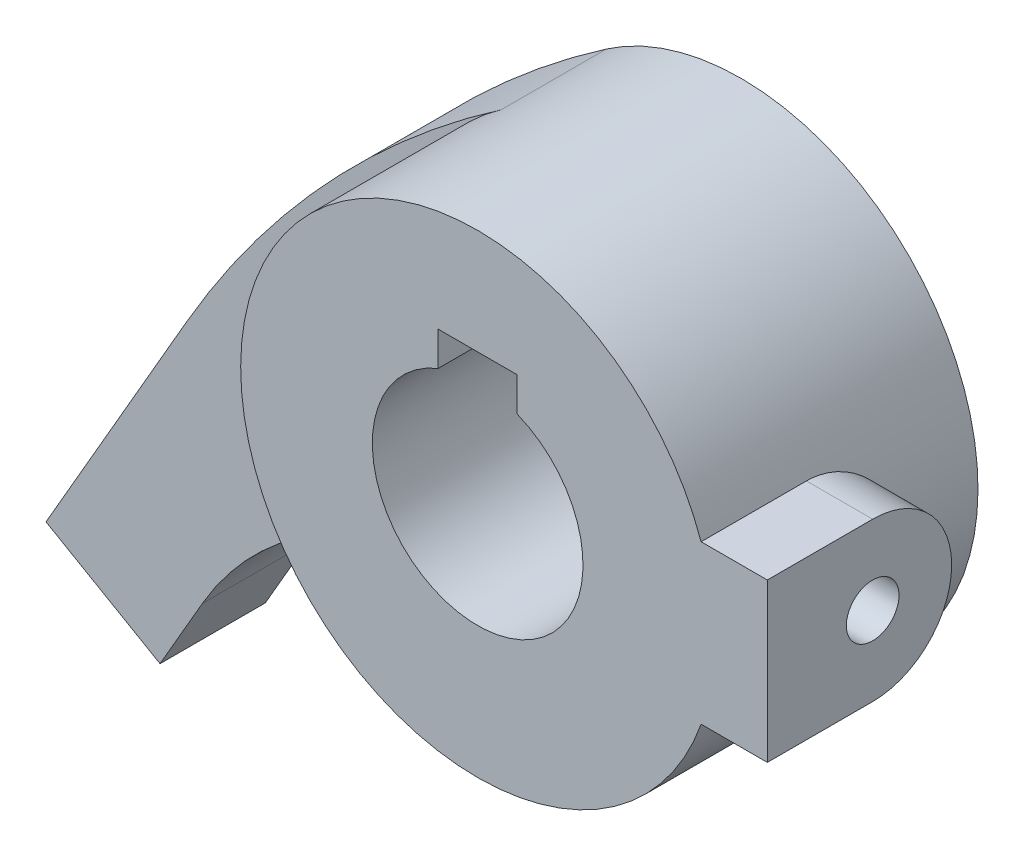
SolidWorks part; units mm, degrees
ref_plane "前视基准面" through (0, 0, 0) normal (0, 0, 1) x (1, 0, 0)
ref_plane "上视基准面" through (0, 0, 0) normal (0, 1, 0) x (1, 0, 0)
ref_plane "右视基准面" through (0, 0, 0) normal (1, 0, 0) x (0, 0, -1)
sketch "草图1" plane through (0, 0, 0) normal (0, 0, 1) x (1, 0, 0)
  line L0 (0, 11.715) -> (0, -12.6704) construction
  line L1 (-12.634, 0) -> (12.1078, 0) construction
  line L2 (-3, 7.4162) -> (-3, 10)
  line L3 (-3, 10) -> (3, 10)
  line L4 (3, 7.4162) -> (3, 10)
  arc A0 (-3, 7.4162) -> (3, 7.4162) centre (0, 0) ccw
  circle A1 centre (0, 0) radius 18
  point P13 (0, 10)
  dimension "D1" = 36
  dimension "D2" = 16
  dimension "D4" = 10
  dimension "D3" = 6
extrude "凸台-拉伸1" add sketch "草图1" along normal blind 20
ref_plane "基准面1" through (22, 0, 0) normal (1, 0, 0) x (0, 0, -1)
sketch "草图2" plane through (22, 0, 0) normal (1, 0, 0) x (0, 0, -1)
  line L0 (-24.8754, 0) -> (-6.9723, 0) construction
  line L1 (-12, 6.7466) -> (-12, -9.8402) construction
  line L2 (-20, 18) -> (-20, -18) construction
  line L3 (-12, 6) -> (-20, 6)
  line L4 (-12, -6) -> (-20, -6)
  line L5 (-20, 6) -> (-20, -6)
  arc A1 (-12, -6) -> (-12, 6) centre (-12, 0) ccw
  dimension "D1" = 6
  dimension "D3" = 8
extrude "凸台-拉伸2" add sketch "草图2" against normal up to next
sketch "草图3" plane through (0, 0, 0) normal (0, 0, 1) x (1, 0, 0)
  line L0 (-34.0887, -11.0434) -> (-44.7846, -29.5692)
  line L1 (-32.909, -29) -> (-36.1244, -34.5692)
  line L2 (-64.6804, -18.0824) -> (-14.5619, -47.0183) construction
  line L3 (0, 0) -> (-40.1698, -69.5762) construction
  line L4 (0, 0) -> (-50.4077, 29.1029) construction
  line L5 (-44.7846, -29.5692) -> (-36.1244, -34.5692)
  arc A0 (-10.2174, 14.8191) -> (-4.7128, -17.3721) centre (0, 0) ccw
  arc A1 (-4.7128, -17.3721) -> (-32.909, -29) centre (-11.2583, -41.5) ccw
  arc A2 (-10.2174, 14.8191) -> (-34.0887, -11.0434) centre (35.1933, -51.0434) ccw
  dimension "D4" = 50
  dimension "D5" = 36
  dimension "D6" = 160
  dimension "D1" = 48
  dimension "D2" = 24
  dimension "D3" = 14
extrude "凸台-拉伸3" add sketch "草图3" along normal blind 8
sketch "草图4" plane through (22, 0, 0) normal (1, 0, 0) x (0, 0, -1)
  circle A0 centre (-12, 0) radius 2
  dimension "D1" = 4
extrude "切除-拉伸1" cut sketch "草图4" against normal blind 20
